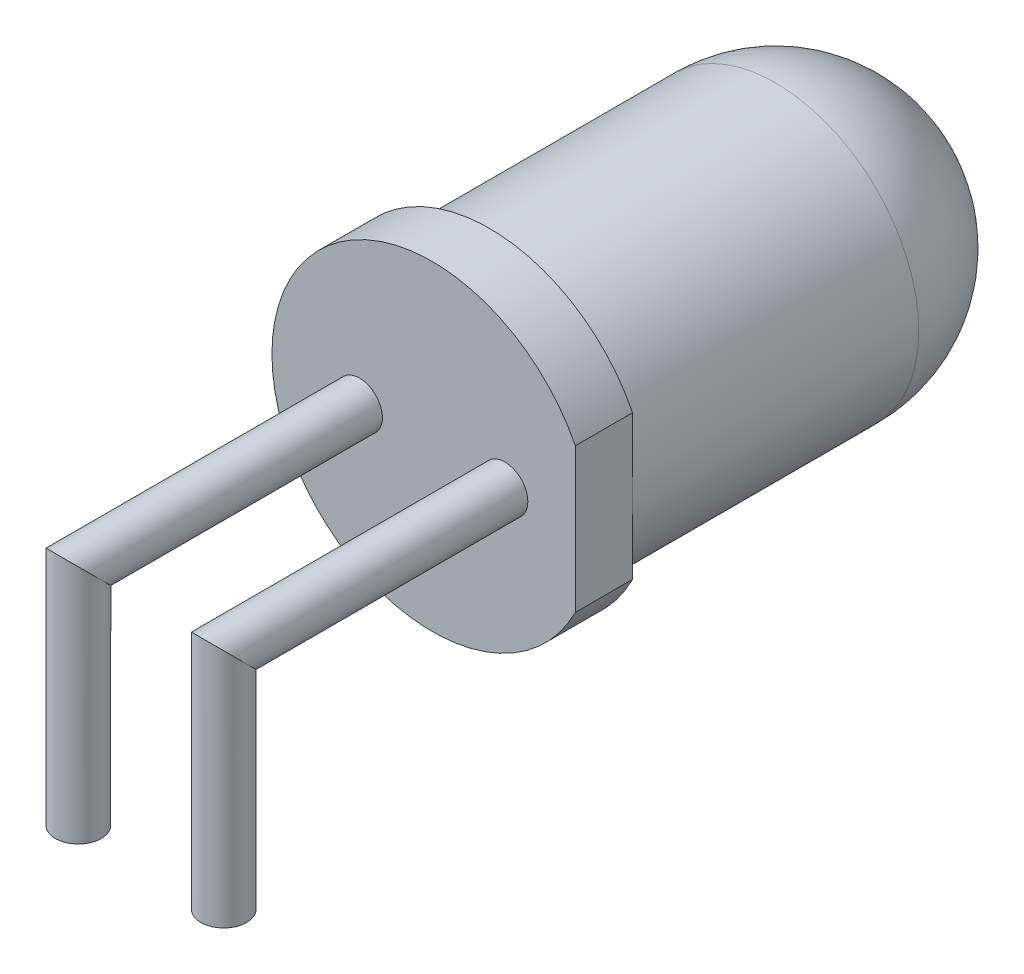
SolidWorks part; units mm, degrees
ref_plane "Face" through (0, 0, 0) normal (0, 0, 1) x (1, 0, 0)
ref_plane "Dessus" through (0, 0, 0) normal (0, 1, 0) x (1, 0, 0)
ref_plane "Droite" through (0, 0, 0) normal (1, 0, 0) x (0, 0, -1)
sketch "Esquisse1" plane through (0, 0, 0) normal (0, 0, 1) x (1, 0, 0)
  circle A0 centre (0, 0) radius 2.5
extrude "Base-Extrusion" add sketch "Esquisse1" along normal blind 8.5
sketch "Esquisse2" plane through (0, 0, 8.5) normal (0, 0, 1) x (1, 0, 0)
  line L0 (2.5, -2.4917) -> (2.5, 2.5621) construction
  line L1 (2.5, 1.261) -> (2.5, -1.261)
  arc A0 (2.5, 1.261) -> (2.5, -1.261) centre (0, 0) ccw
extrude "Boss.-Extru.1" add sketch "Esquisse2" against normal blind 1
fillet "Congé1" radius 2.5 1 edges at (2.5, 0, 0)
sketch "Esquisse3" plane through (0, 0, 8.5) normal (0, 0, 1) x (1, 0, 0)
  line L0 (0, 0.821) -> (0, -0.6443) construction
  circle A0 centre (-1.27, 0) radius 0.4
  circle A1 centre (1.27, 0) radius 0.4
  dimension "D1" = 0.8
  dimension "D2" = 2.54
sketch "Esquisse4" plane through (0, 0, 0) normal (1, 0, 0) x (0, 0, -1)
  line L0 (-8.5, 0.0884) -> (-13.5, 0.0884)
  line L1 (-8.5, 0.821) -> (-8.5, -0.6443) construction
  line L2 (-13.5, 0.0884) -> (-13.5, -3.9116)
  dimension "D1" = 5
  dimension "D2" = 4
sweep "Balayage1" add profiles "Esquisse3" path "Esquisse4"
